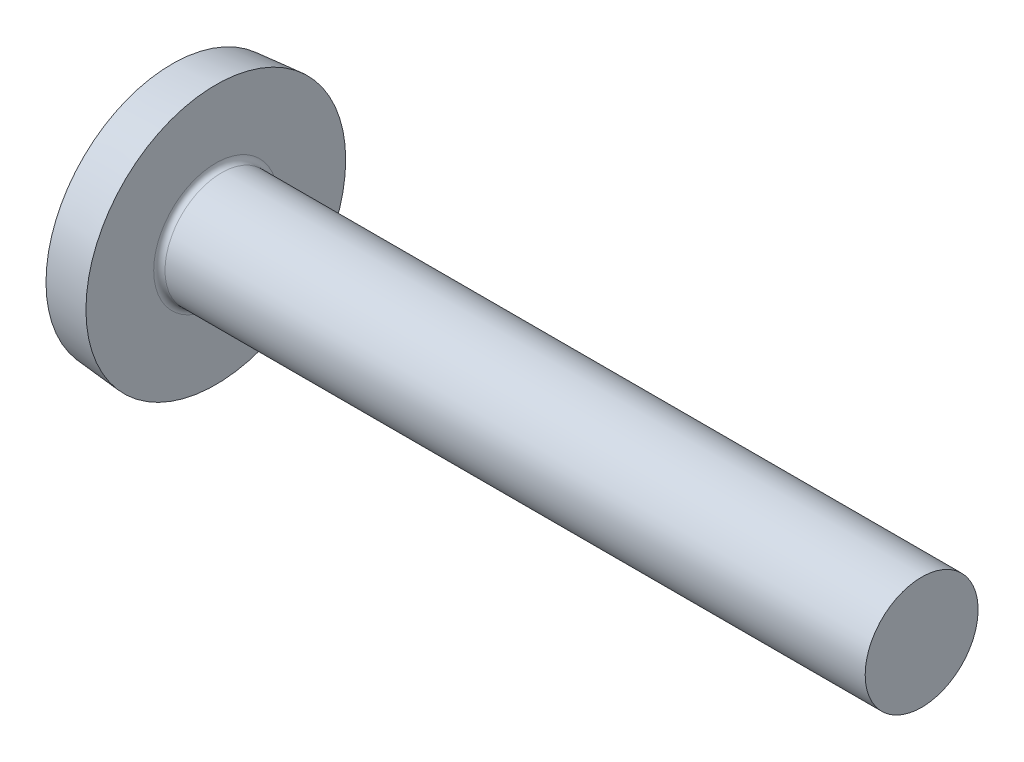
SolidWorks part; units mm, degrees
ref_plane "Front Plane" through (0, 0, 0) normal (0, 0, 1) x (1, 0, 0)
ref_plane "Top Plane" through (0, 0, 0) normal (0, 1, 0) x (1, 0, 0)
ref_plane "Right Plane" through (0, 0, 0) normal (1, 0, 0) x (0, 0, -1)
other "Configuration Table"
sketch "BodySke" plane through (0, 0, 0) normal (0, 0, 1) x (1, 0, 0)
  line L0 (0, 0) -> (64.6736, 0) construction
  line L1 (0, 0) -> (0, 8) construction
  line L2 (4.8, 4) -> (4.8, 9.2)
  line L3 (4.8, 9.2) -> (1.7, 8.9288)
  line L4 (4.8, 4) -> (54.8, 4)
  line L5 (54.8, 4) -> (54.8, 0)
  line L6 (6.05, 7.824) -> (6.05, -6.8939) construction
  line L7 (0, 0) -> (54.8, 0)
  line L8 (24.8, 8.3681) -> (24.8, -5.4139) construction
  arc A0 (0, 0) -> (1.7, 8.9288) centre (24.298, 0) cw
  point P10 (54.8, 3.4455)
revolve "BaseBody" add sketch "BodySke" angle 360 about L0
fillet "Fillet1" radius 0.4 1 edges at (4.8, 0, 4)
ref_plane "Plane1" through (4.38, 0, 0) normal (1, 0, 0) x (0, 0, -1)
sketch "RecSkeTop" plane through (0, 0, 0) normal (1, 0, 0) x (0, 0, -1)
  line L1 (-0.858, 3.9) -> (0.858, 3.9)
  line L2 (-0.858, 3.9) -> (-0.858, -3.9)
  line L3 (-0.858, -3.9) -> (0.858, -3.9)
  line L4 (0.858, 3.9) -> (0.858, -3.9)
sketch "RecSkeBot" plane through (4.38, 0, 0) normal (1, 0, 0) x (0, 0, -1)
  line L0 (-0.858, 3.9) -> (-0.858, -3.9) construction
  line L1 (-0.858, 1.7162) -> (0.858, 1.7162)
  line L2 (-0.858, 1.7162) -> (-0.858, -1.7162)
  line L3 (-0.858, -1.7162) -> (0.858, -1.7162)
  line L4 (0.858, 1.7162) -> (0.858, -1.7162)
  line L5 (0.858, 3.9) -> (0.858, -3.9) construction
loft "Recess" cut profiles "RecSkeTop", "RecSkeBot"
pattern_circular "RecPat" count 2 every 90 about axis through (0, 0, 0) along (1, 0, 0) of "Recess"
sketch "RecCorSke" plane through (0, 0, 0) normal (0, 0, 1) x (1, 0, 0)
  line L0 (0, 0) -> (57.5987, 0) construction
  line L1 (0, 0) -> (0, 1.8876)
  line L3 (0, 1.8876) -> (4.38, 1.5813)
  line L4 (4.38, 1.5813) -> (4.8938, 0)
  line L5 (4.8938, 0) -> (0, 0)
revolve "RecessCore" cut sketch "RecCorSke" angle 360 about L0
sketch "ThdSchSke" plane through (0, 0, 0) normal (0, 0, 1) x (1, 0, 0)
  line L0 (0, 0) -> (55.1256, 0) construction
  line L1 (0, 0) -> (64.6736, 0) construction
  line L2 (54.4799, 4) -> (54.4799, 4.6403)
  line L3 (54.4799, 4.6403) -> (55.1201, 4.6403)
  line L4 (55.1201, 4.6403) -> (55.1201, 4)
  line L5 (55.1201, 4) -> (54.8, 3.4455)
  line L6 (54.8, 3.4455) -> (54.4799, 4)
  line L7 (4.8, 4) -> (54.8, 4) construction
  line L13 (54.8, 4) -> (54.8, 0) construction
revolve "ThreadSchematic" [suppressed] cut sketch "ThdSchSke" angle 360 about L0
pattern_linear "ThdSchPat" [suppressed] count 24 along (1, 0, 0)
equation "\"Thread_minor@ThreadCosmetic\" = \"Thread_minor@BodySke\""
equation "\"D1@RecSkeTop\" = \"Cross_dia@RecSkeTop\" / 2"
equation "\"D2@RecSkeTop\" = \"Cross_dia@RecSkeTop\" * 0.22"
equation "\"D3@RecSkeTop\" = \"D2@RecSkeTop\" / 2"
equation "\"D1@RecSkeBot\" = \"Cross_dia@RecSkeTop\" - 2 * \"Cross_depth@Plane1\" *  tan( 26.5 * 0.017453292 ) "
equation "\"D2@RecSkeBot\" = \"D1@RecSkeBot\" / 2"
equation "\"D2@RecCorSke\" = \"Cross_depth@Plane1\""
equation "\"D3@RecCorSke\" = \"D2@RecSkeTop\" * 1.1"
equation "\"Advance@ThdSchPat\" = \"Advance@BodySke\""
equation "\"D1@ThdSchPat\" =  int( \"Thread_length@BodySke\" / \"Advance@ThdSchPat\" ) "
